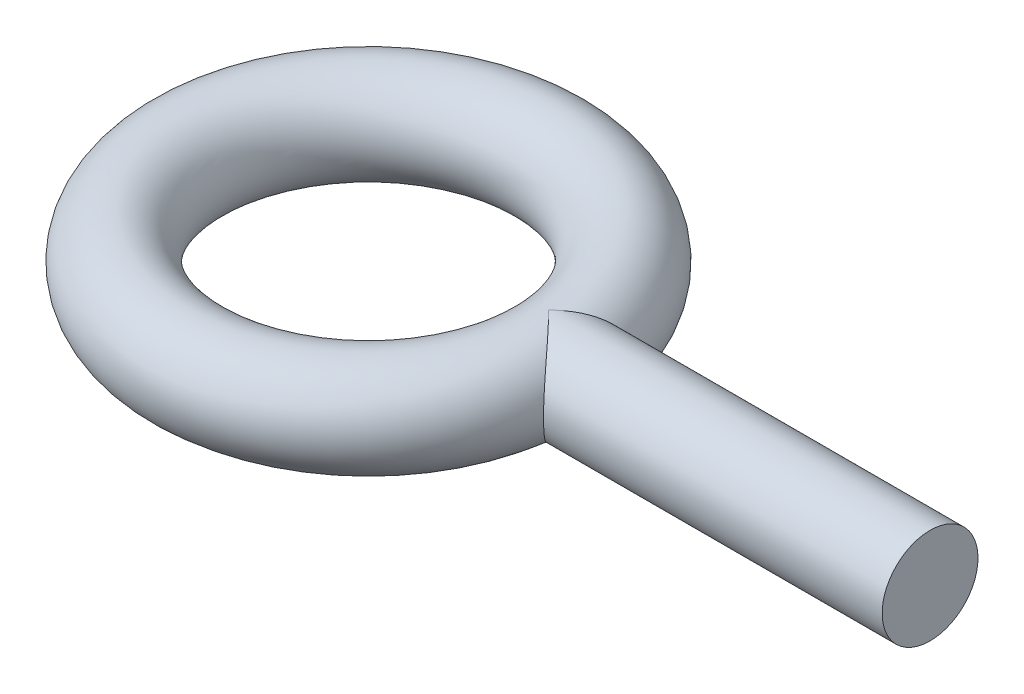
SolidWorks part; units mm, degrees
ref_plane "Front Plane" through (0, 0, 0) normal (0, 0, 1) x (1, 0, 0)
ref_plane "Top Plane" through (0, 0, 0) normal (0, 1, 0) x (1, 0, 0)
ref_plane "Right Plane" through (0, 0, 0) normal (1, 0, 0) x (0, 0, -1)
other "Configuration Table"
sketch "layout" plane through (0, 0, 0) normal (0, 1, 0) x (1, 0, 0)
  line L0 (0, 0) -> (37.211, 0) construction
  circle A0 centre (0, 0) radius 15.113 construction
  dimension "D1" = 30.226
  dimension "D2" = 52.324
sketch "Sketch2" plane through (0, 0, 0) normal (0, 0, 1) x (1, 0, 0)
  line L3 (0, 0) -> (0, 6.6909) construction
  line L4 (15.113, 0) -> (-15.113, 0) construction
  circle A0 centre (-11.938, 0) radius 3.175
  point P4 (-15.113, 0)
revolve "Revolve1" add sketch "Sketch2" angle 360 about L3
ref_plane "Plane1" through (37.211, 0, 0) normal (1, 0, 0) x (0, 0, -1)
sketch "Sketch3" plane through (37.211, 0, 0) normal (1, 0, 0) x (0, 0, -1)
  circle A0 centre (0, 0) radius 3.175
extrude "Extrude1" add sketch "Sketch3" against normal up to next
sketch "Sketch4" plane through (0, 0, 0) normal (0, 1, 0) x (1, 0, 0)
  line L0 (36.7527, 3.175) -> (37.211, 2.3812)
  line L1 (37.211, 2.3812) -> (37.6693, 3.175)
  line L2 (37.6693, 3.175) -> (37.6693, 4.0915)
  line L3 (37.6693, 4.0915) -> (36.7527, 4.0915)
  line L4 (36.7527, 4.0915) -> (36.7527, 3.175)
  line L5 (0, 0) -> (42.1538, 0) construction
revolve "Cut-Revolve1" [suppressed] cut sketch "Sketch4" angle 360 about L5
pattern_linear "LPattern1" [suppressed] count 15 along (1, 0, 0)
equation "\"A@Sketch3\" = \"D1@Sketch2\""
equation "\"D1@Sketch4\" = \"D2@Cosmetic Thread1\""
equation "\"D2@Sketch4\" = \"D1@Sketch2\""
equation "\"D1@LPattern1\" = \"D1@Cosmetic Thread1\" / \"p@LPattern1\""
